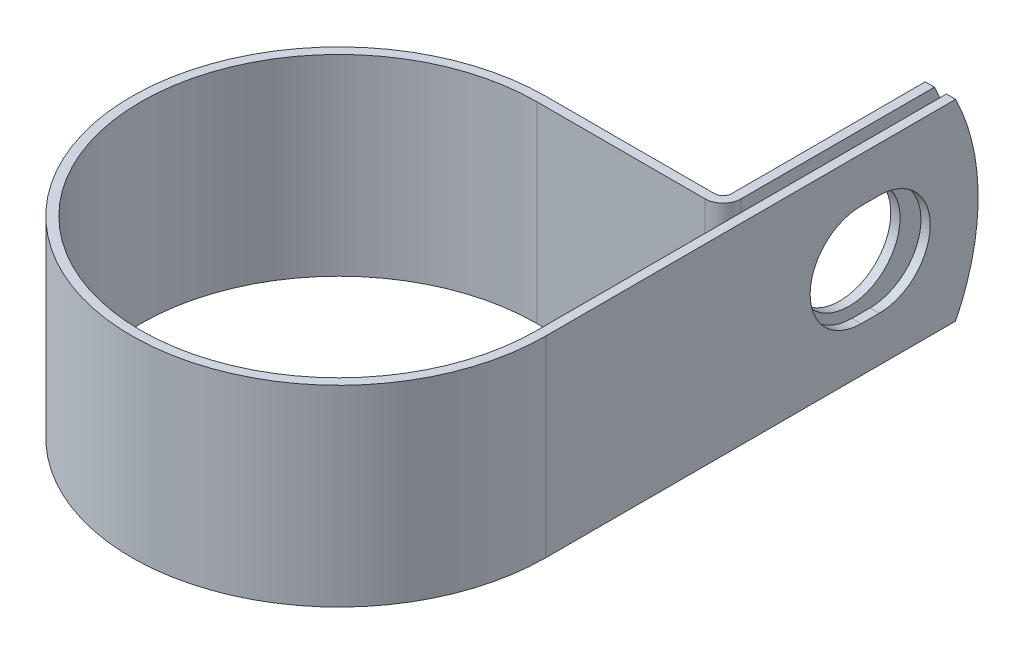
SolidWorks part; units mm, degrees
ref_plane "Front Plane" through (0, 0, 0) normal (0, 0, 1) x (1, 0, 0)
ref_plane "Top Plane" through (0, 0, 0) normal (0, 1, 0) x (1, 0, 0)
ref_plane "Right Plane" through (0, 0, 0) normal (1, 0, 0) x (0, 0, -1)
sketch "Sketch1" plane through (0, 0, 0) normal (0, 1, 0) x (1, 0, 0)
  line L0 (0, 26.1874) -> (22.2352, 26.1874)
  line L1 (26.1874, 0) -> (26.1874, 26.1874)
  line L2 (24.6126, 57.1246) -> (24.6126, 28.5648)
  line L5 (26.1874, 26.1874) -> (26.1874, 57.1246)
  arc A0 (0, 26.1874) -> (26.1874, 0) centre (0, 0) ccw
  arc A3 (22.2352, 26.1874) -> (24.6126, 28.5648) centre (22.2352, 28.5648) ccw
extrude "Extrude-Thin1" add sketch "Sketch1" along normal mid plane 25.4 thin
sketch "Sketch2" plane through (23.3934, 0, 0) normal (-1, 0, 0) x (0, 0, 1)
  line L0 (-57.1246, 12.7) -> (-57.1246, -12.7) construction
  line L7 (0, 12.7) -> (0, -12.7) construction
  circle A0 centre (-42.8498, 0) radius 6.7437
  point P2 (-57.1246, 0)
extrude "Cut-Extrude1" cut sketch "Sketch2" against normal up to surface (1.2192 mm away)
sketch "Sketch3" plane through (27.4066, 0, 0) normal (1, 0, 0) x (0, 0, -1)
  line L0 (41.656, 0) -> (44.0436, 0) construction
  line L1 (41.656, 6.7437) -> (44.0436, 6.7437)
  line L2 (41.656, -6.7437) -> (44.0436, -6.7437)
  line L3 (57.1246, 12.7) -> (57.1246, -12.7) construction
  arc A0 (41.656, 6.7437) -> (41.656, -6.7437) centre (41.656, 0) ccw
  arc A1 (44.0436, -6.7437) -> (44.0436, 6.7437) centre (44.0436, 0) ccw
  point P3 (42.8498, 0)
  point P8 (57.1246, 0)
  point P11 (34.9123, 0)
  point P12 (50.7873, 0)
extrude "Cut-Extrude2" cut sketch "Sketch3" against normal up to surface (1.2192 mm away)
sketch "Sketch4" plane through (23.3934, 0, 0) normal (-1, 0, 0) x (0, 0, 1)
  line L0 (-57.1246, 12.7) -> (-57.1246, -12.7)
  line L1 (-57.1246, 12.7) -> (-54.1473, 12.7)
  line L2 (-57.1246, 12.7) -> (-28.5648, 12.7) construction
  line L3 (-57.1246, -12.7) -> (-54.1473, -12.7)
  line L4 (-57.1246, -12.7) -> (-28.5648, -12.7) construction
  arc A0 (-54.1473, 12.7) -> (-54.1473, -12.7) centre (-28.5496, 0) ccw
extrude "Cut-Extrude3" cut sketch "Sketch4" against normal through all contours A0 M4 M5 | A0 L0 M2
equation "\"D1@Sketch3\" = \"D2@Sketch2\""
equation "\"D7@Sketch1\" = \"D3@Sketch2\" + \"D1@Sketch3\""
equation "\"D1@Sketch4\" = ( \"D1@Extrude-Thin1\" + .125 ) * 2"
equation "\"D2@Sketch1\"=1.95*\"D5@Extrude-Thin1\""
equation "\"D2@Sketch3\" = \"D1@Sketch2\""
